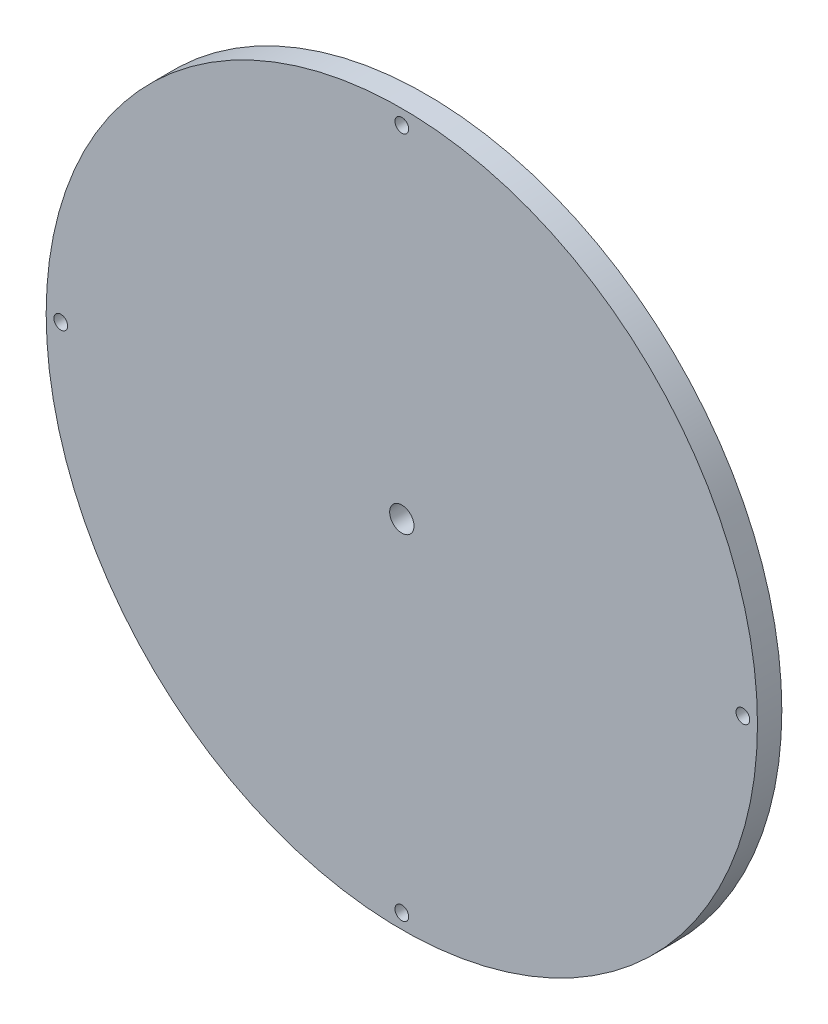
SolidWorks part; units mm, degrees
ref_plane "Front Plane" through (0, 0, 0) normal (0, 0, 1) x (1, 0, 0)
ref_plane "Top Plane" through (0, 0, 0) normal (0, 1, 0) x (1, 0, 0)
ref_plane "Right Plane" through (0, 0, 0) normal (1, 0, 0) x (0, 0, -1)
sketch "Sketch1" plane through (0, 0, 0) normal (0, 0, 1) x (1, 0, 0)
  line L0 (0, 88.9) -> (0, 0) construction
  line L1 (-88.9, 0) -> (0, 0) construction
  circle A0 centre (0, 0) radius 92.71
  circle A5 centre (0, 0) radius 3.175
  circle A6 centre (0, 88.9) radius 1.7859
  circle A7 centre (88.9, 0) radius 1.7859
  circle A8 centre (0, -88.9) radius 1.7859
  circle A9 centre (-88.9, 0) radius 1.7859
  point P14 (0, 0)
  point P16 (0, 0)
  dimension "D1" = 185.42
  dimension "D2" = 6.35
  dimension "D3" = 3.5719
  dimension "D5" = 4
  dimension "D4" = 88.9
  dimension "D6" = 88.9
extrude "Boss-Extrude1" add sketch "Sketch1" along normal blind 6.35
